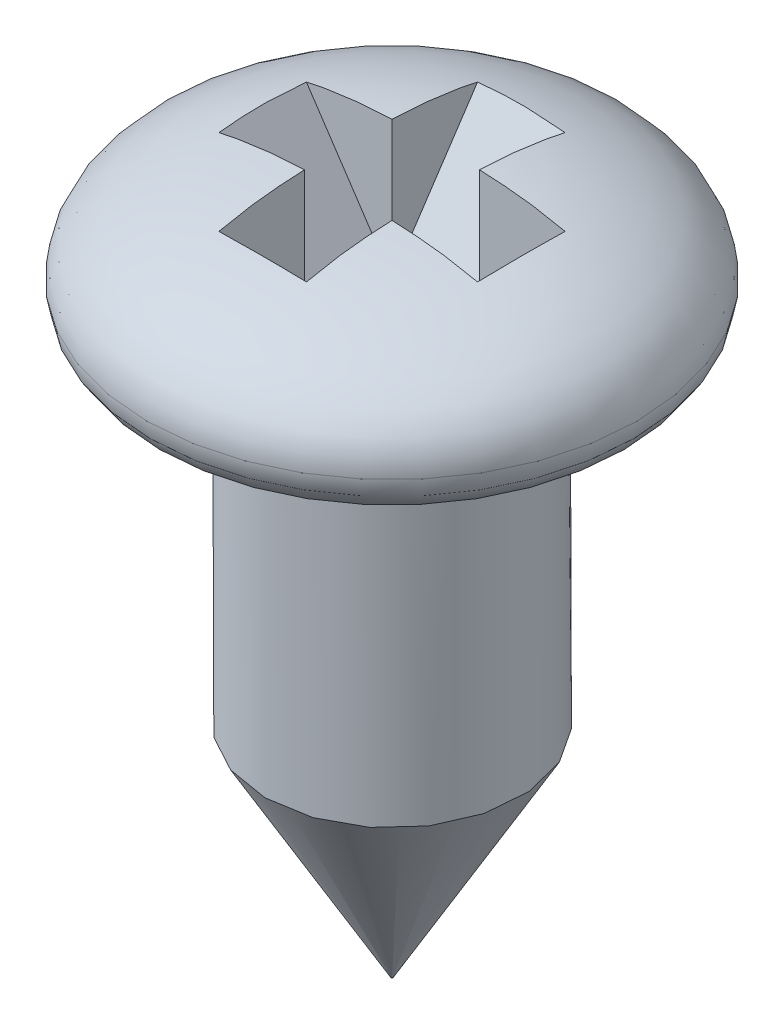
SolidWorks part; units mm, degrees
ref_plane "Plan de face" through (0, 0, 0) normal (0, 0, 1) x (1, 0, 0)
ref_plane "Plan de dessus" through (0, 0, 0) normal (0, 1, 0) x (1, 0, 0)
ref_plane "Plan de droite" through (0, 0, 0) normal (1, 0, 0) x (0, 0, -1)
sketch "Esquisse1" plane through (0, 0, 0) normal (0, 1, 0) x (1, 0, 0)
  circle A0 centre (0, 0) radius 1.45
extrude "Extrusion1" add sketch "Esquisse1" along normal blind 6.4
sketch "Esquisse2" plane through (0, 0, 0) normal (0, 0, 1) x (1, 0, 0)
  line L0 (-3.5764, 6.4) -> (3.9855, 6.4) construction
  line L1 (0, 8.9067) -> (0, 4.7448) construction
  line L2 (-2.6992, 8) -> (4.0303, 8) construction
  line L3 (-2.8, 8.6386) -> (-2.8, 5.3938) construction
  line L4 (0, 6.4) -> (-2.3, 6.4)
  line L5 (0, 8) -> (0, 6.4)
  arc A0 (-2.3, 6.4) -> (-2.8, 6.9001) centre (-2.3, 6.9) cw
  spline S0 degree 3 poles (-2.8, 6.9001) (-2.802, 7.3106) (-1.7042, 7.9956) (-0.6729, 7.9983) (0, 8) knots 0 0 0 0 0.347597 1 1 1 1
  point P15 (-2.8, 6.4)
  point P18 (-2.8, 8)
  point P21 (0, 6.4)
  dimension "D1" = 0.5
revolve "Révolution1" add sketch "Esquisse2" angle 360 about L1
sketch "Esquisse3" plane through (0, 0, 0) normal (0, 0, 1) x (1, 0, 0)
  line L0 (0, 9.9885) -> (0, 5.1977) construction
  line L1 (-3.3122, 6.4) -> (4.0377, 6.4) construction
  line L2 (-3.6691, 0) -> (6.2564, 0) construction
  line L3 (-1.5, 8.9361) -> (-1.5, 5.7428) construction
  line L4 (-0.5, 7.218) -> (-0.5, 5.7428) construction
  line L5 (0, 8.589) -> (-1.5, 8.3981)
  line L6 (-2.5295, 7.9) -> (1.4809, 7.9) construction
  line L7 (-1.5, 8.3981) -> (-1.5, 7.9)
  line L8 (-1.5, 7.9) -> (-0.5, 6.4)
  line L9 (-0.5, 6.4) -> (0.5, 6.4)
  line L10 (1.5, 7.9) -> (0.5, 6.4)
  line L11 (1.5, 8.3981) -> (1.5, 7.9)
  line L12 (0, 8.589) -> (1.5, 8.3981)
  point P19 (0, 6.4)
extrude "Enlèv. mat.-Extru.1" cut sketch "Esquisse3" against normal mid plane 1
pattern_circular "Répétition circulaire1" count 2 every 90 about axis through (0, 0, 0) along (0, 1, 0) of "Enlèv. mat.-Extru.1"
chamfer "Chanfrein1" distance 1.44 distance2 2.5 1 edges at (0, 0, 1.45)
